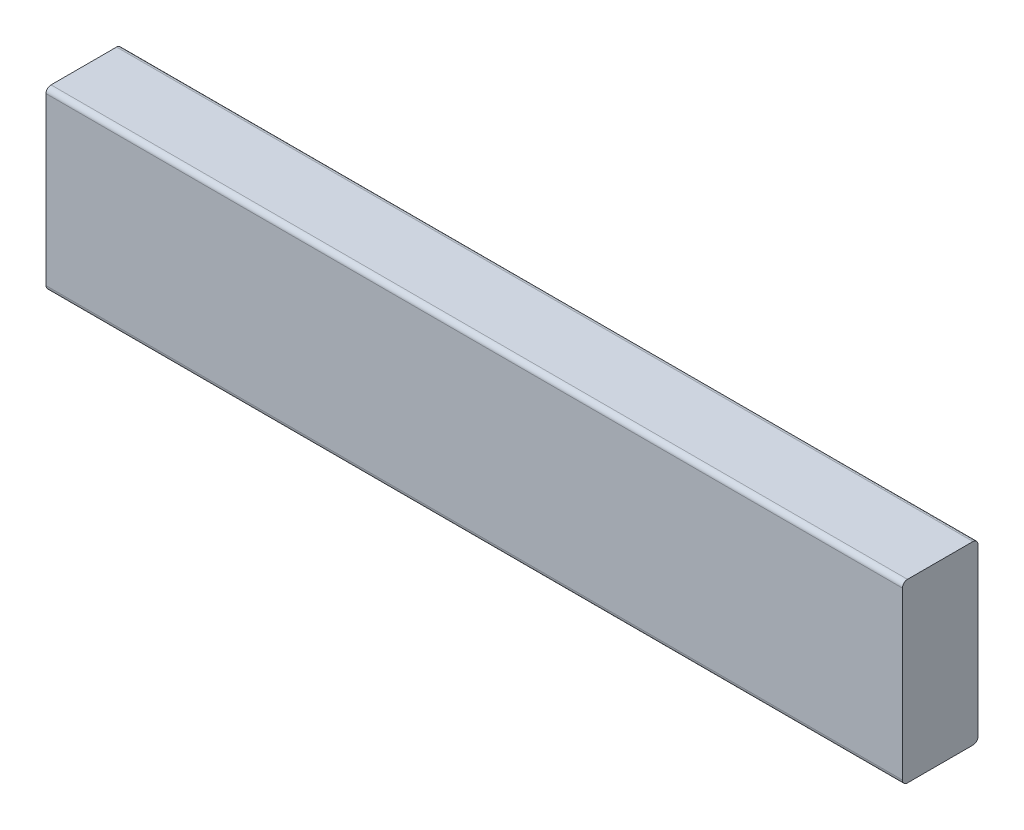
SolidWorks part; units mm, degrees
ref_plane "Front Plane" through (0, 0, 0) normal (0, 0, 1) x (1, 0, 0)
ref_plane "Top Plane" through (0, 0, 0) normal (0, 1, 0) x (1, 0, 0)
ref_plane "Right Plane" through (0, 0, 0) normal (1, 0, 0) x (0, 0, -1)
sketch "Sketch1" plane through (0, 0, 0) normal (1, 0, 0) x (0, 0, -1)
  line L1 (-19.05, -44.45) -> (19.05, -44.45)
  line L2 (-19.05, -44.45) -> (-19.05, 44.45)
  line L3 (-19.05, 44.45) -> (19.05, 44.45)
  line L4 (19.05, -44.45) -> (19.05, 44.45)
  line L5 (-19.05, -44.45) -> (19.05, 44.45) construction
  line L6 (-19.05, 44.45) -> (19.05, -44.45) construction
  point P0 (0, 0)
  dimension "D1" = 38.1
  dimension "D2" = 88.9
extrude "Extrude1" add sketch "Sketch1" along normal mid plane 431.8
fillet "Fillet1" radius 2.54 4 edges at (0, -44.45, 19.05) (0, -44.45, -19.05) (0, 44.45, -19.05) (0, 44.45, 19.05)
